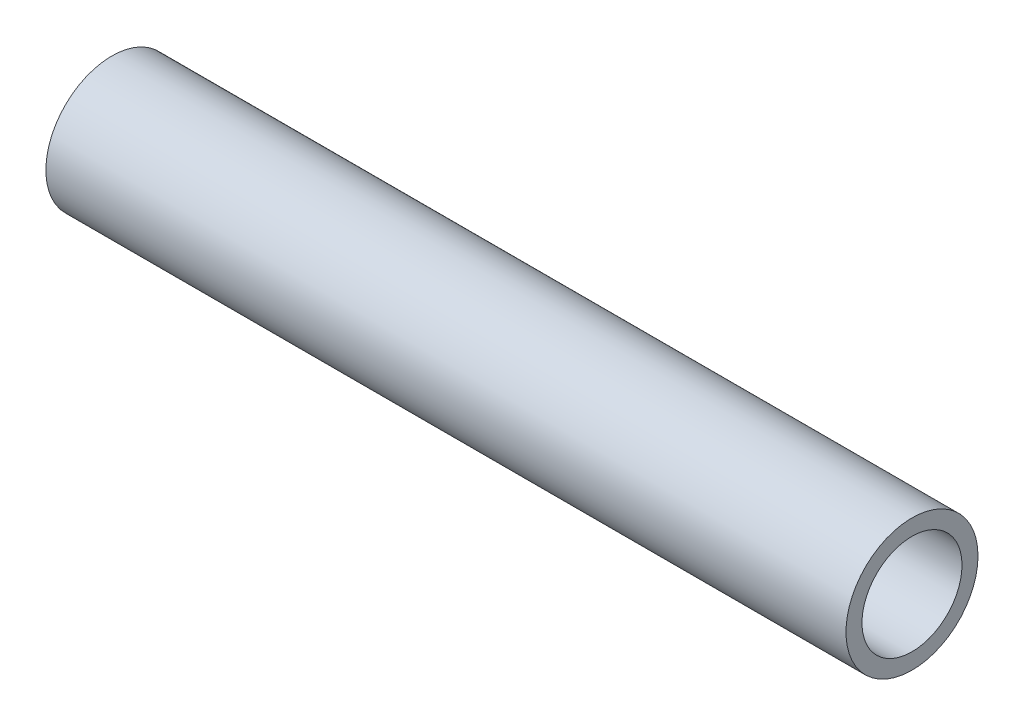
SolidWorks part; units mm, degrees
ref_plane "Plan de face" through (0, 0, 0) normal (0, 0, 1) x (1, 0, 0)
ref_plane "Plan de dessus" through (0, 0, 0) normal (0, 1, 0) x (1, 0, 0)
ref_plane "Plan de droite" through (0, 0, 0) normal (1, 0, 0) x (0, 0, -1)
sketch "Esquisse1" plane through (0, 0, 0) normal (1, 0, 0) x (0, 0, -1)
  circle A0 centre (0, 0) radius 6.25
  circle A1 centre (0, 0) radius 8.25
  dimension "D1" = 16.5
  dimension "D2" = 12.5
extrude "Boss.-Extru.1" add sketch "Esquisse1" along normal blind 100
